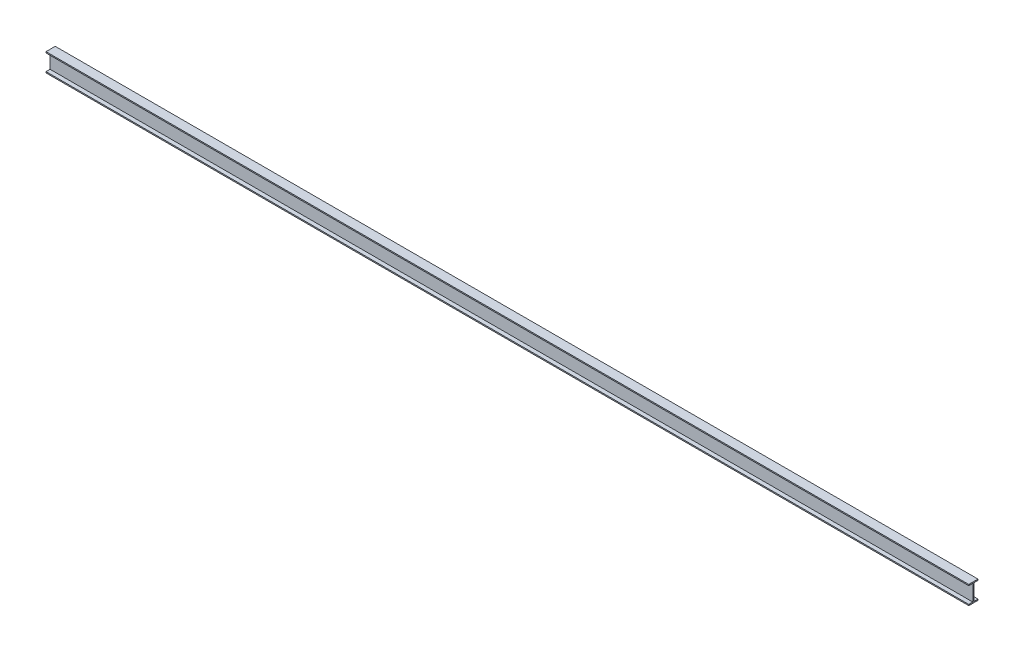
SolidWorks part; units mm, degrees
ref_plane "Plan de face" through (0, 0, 0) normal (0, 0, 1) x (1, 0, 0)
ref_plane "Plan de dessus" through (0, 0, 0) normal (0, 1, 0) x (1, 0, 0)
ref_plane "Plan de droite" through (0, 0, 0) normal (1, 0, 0) x (0, 0, -1)
sketch "Esquisse1" plane through (0, 0, 0) normal (1, 0, 0) x (0, 0, -1)
  line L0 (-40, 0) -> (40, 0)
  line L1 (40, 10) -> (5, 10)
  line L2 (5, 10) -> (5, 150)
  line L3 (5, 150) -> (40, 150)
  line L4 (40, 150) -> (40, 160)
  line L5 (40, 160) -> (-40, 160)
  line L6 (-40, 160) -> (-40, 150)
  line L7 (-40, 150) -> (-5, 150)
  line L8 (-5, 150) -> (-5, 10)
  line L9 (-5, 10) -> (-40, 10)
  line L10 (-40, 10) -> (-40, 0)
  line L11 (40, 0) -> (40, 10)
  line L12 (-5, 80) -> (5, 80) construction
  dimension "D1" = 80
  dimension "D2" = 160
  dimension "D3" = 10
extrude "Boss.-Extru.1" add sketch "Esquisse1" along normal blind 8000
